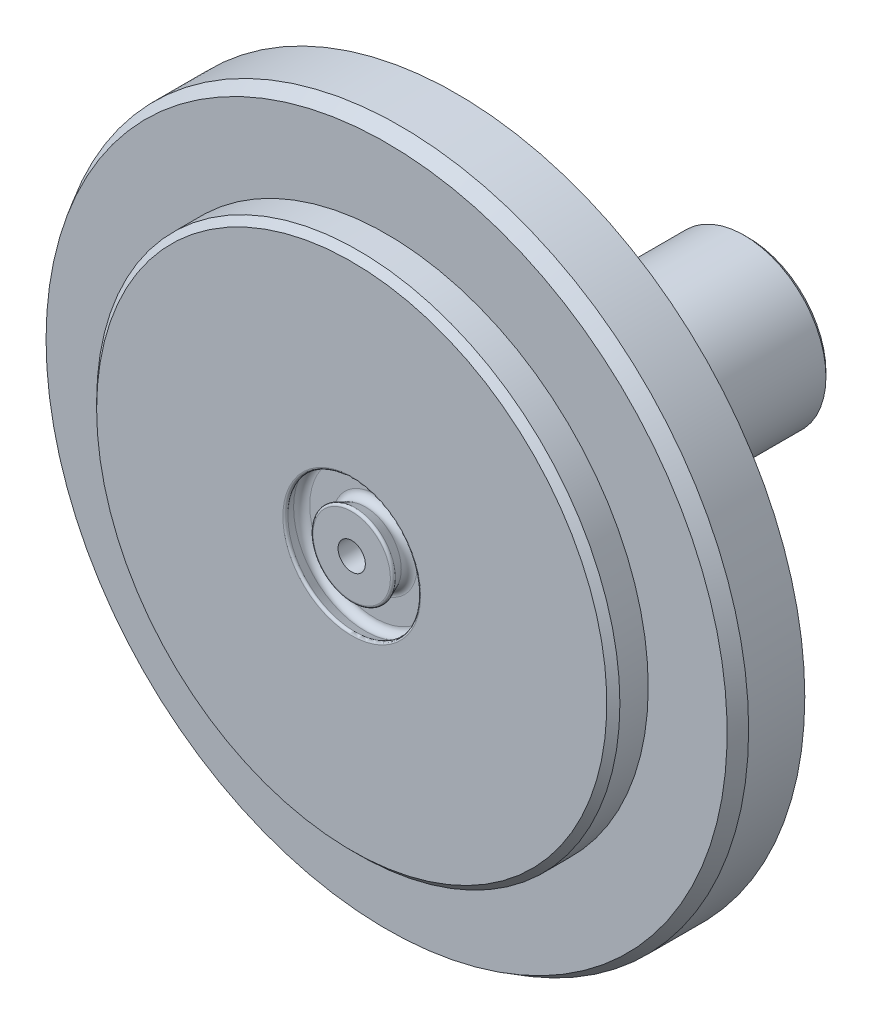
SolidWorks part; units mm, degrees
ref_plane "Front Plane" through (0, 0, 0) normal (0, 0, 1) x (1, 0, 0)
ref_plane "Top Plane" through (0, 0, 0) normal (0, 1, 0) x (1, 0, 0)
ref_plane "Right Plane" through (0, 0, 0) normal (1, 0, 0) x (0, 0, -1)
sketch "Sketch1" plane through (0, 0, 0) normal (0, 0, 1) x (1, 0, 0)
  circle A0 centre (0, 0) radius 15.24
  dimension "D1" = 30.48
extrude "Extrude1" add sketch "Sketch1" along normal mid plane 2.032
sketch "Sketch4" plane through (0, 0, 0) normal (1, 0, 0) x (0, 0, -1)
  line L0 (0, 0) -> (-4.9789, 0) construction
  line L1 (-1.016, 2.4479) -> (0.3301, 2.4479) construction
  line L2 (-1.016, 3.8161) -> (-1.016, 2.4479)
  line L3 (-1.016, 2.4479) -> (-0.2272, 2.0967)
  line L4 (0.3302, 3.1242) -> (-4.7336, 3.1242) construction
  line L5 (-0.2415, 4.1609) -> (-1.016, 3.8161)
  line L6 (0.3302, 2.4587) -> (0.3302, 3.7897)
  line L7 (-0.066, 2.0625) -> (-0.066, 2.4479) construction
  line L10 (-1.016, 15.24) -> (-1.016, -15.24) construction
  arc A0 (-0.2272, 2.0967) -> (0.3302, 2.4587) centre (-0.066, 2.4587) ccw
  arc A1 (-0.2415, 4.1609) -> (0.3302, 3.7897) centre (-0.0762, 3.7897) cw
  dimension "D3" = 0.3962
  dimension "D5" = 0.4064
  dimension "D2" = 3.1242
  dimension "D9" = 2.1336
  dimension "D7" = 4.1961
  dimension "D1" = 1.3462
  dimension "D4" = 66
  dimension "D6" = 66
  dimension "D8" = 0.3855
revolve "O-RING GROOVE" cut sketch "Sketch4" angle 360 about L0
sketch "Sketch26" plane through (0, 0, -1.016) normal (0, 0, -1) x (-1, 0, 0)
  circle A0 centre (0, 0) radius 20.2946
  dimension "D1" = 40.5892
extrude "Extrude3" add sketch "Sketch26" along normal blind 2.032
sketch "Sketch5" plane through (0, 0, -3.048) normal (0, 0, -1) x (-1, 0, 0)
  circle A0 centre (0, 0) radius 4.7625
  dimension "D1" = 9.525
extrude "Extrude2" add sketch "Sketch5" along normal blind 19.05
hole_wizard ".25-28 middle" positions "Sketch22" profile "Sketch23" legacy
sketch "Sketch22" plane through (13.9719, -66.055, -22.098) normal (0, 0, -1) x (-1, 0, 0)
  point P0 (13.9719, 66.055)
sketch "Sketch23" plane through (0, 0, -22.098) normal (1, 0, 0) x (0, 1, 0)
  line L0 (0, 0) -> (0, 7.9375)
  line L1 (0, 7.9375) -> (2.7051, 7.9375)
  line L2 (2.7051, 7.9375) -> (2.7051, 7.0307)
  line L3 (2.7051, 7.0307) -> (3.175, 7.0307)
  line L4 (3.175, 7.0307) -> (3.175, 0.6132)
  line L5 (3.175, 0.6132) -> (3.429, 0)
  line L6 (3.429, 0) -> (0, 0)
hole_wizard "Hole1" positions "Sketch25" profile "Sketch24" hole size "1/16" standard "Ansi Inch"
sketch "Sketch25" plane through (0.051, 13.0934, -14.1605) normal (0, 0, -1) x (-1, 0, 0)
  point P0 (0.051, -13.0934)
sketch "Sketch24" plane through (0, 0, -14.1605) normal (1, 0, 0) x (0, 1, 0)
  line L0 (0, 0) -> (0, 15.1765)
  line L1 (0, 15.1765) -> (0.7937, 15.1765)
  line L2 (0.7937, 15.1765) -> (0.7937, 0)
  line L5 (0.7937, 0) -> (0, 0)
  line L11 (0, -6.35) -> (0, 107.95) construction
  dimension "Thru Hole Dia." = 1.5875
  dimension "Thru Hole Depth" = 15.1765
other "Flat Bottom-.25-28<1>"
sketch "Sketch27" plane through (0, 0, -3.048) normal (0, 0, -1) x (-1, 0, 0)
  circle A0 centre (0, 0) radius 20.2946 construction
  circle A1 centre (0, 0) radius 20.2946
  circle A2 centre (0, 0) radius 15.3035
  dimension "D1" = 30.607
extrude "Pocket" add sketch "Sketch27" along normal blind 2.032
sketch "Sketch28" plane through (0, 0, 0) normal (1, 0, 0) x (0, 0, -1)
  line L0 (0, 0) -> (18.2124, 0) construction
  line L1 (22.098, 0) -> (3.048, 0) construction
  line L2 (-1.016, 0) -> (1.016, 0) construction
  line L3 (22.098, -4.7625) -> (22.098, 4.7625) construction
  line L4 (9.906, 5.6515) -> (10.922, 5.6515)
  line L5 (9.906, 5.6515) -> (9.906, 4.1275)
  line L6 (9.906, 4.1275) -> (10.922, 4.1275)
  line L7 (10.922, 5.6515) -> (10.922, 4.1275)
  dimension "D1" = 1.016
  dimension "D2" = 8.255
  dimension "D3" = 11.176
  dimension "D4" = 1.524
revolve "Cut-Revolve1" cut sketch "Sketch28" angle 360 about L0
chamfer "Chamfer1" distance 0.254 angle 45 1 edges at (-4.7625, 0, -22.098)
chamfer "Chamfer2" distance 0.381 angle 45 1 edges at (15.24, 0, 1.016)
chamfer "Chamfer3" distance 0.7937 angle 30 1 edges at (-20.2946, 0, -1.016)
fillet "Fillet1" radius 0.127 1 edges at (-3.8161, 0, 1.016)
fillet "Fillet2" radius 0.127 1 edges at (-2.4479, 0, 1.016)
